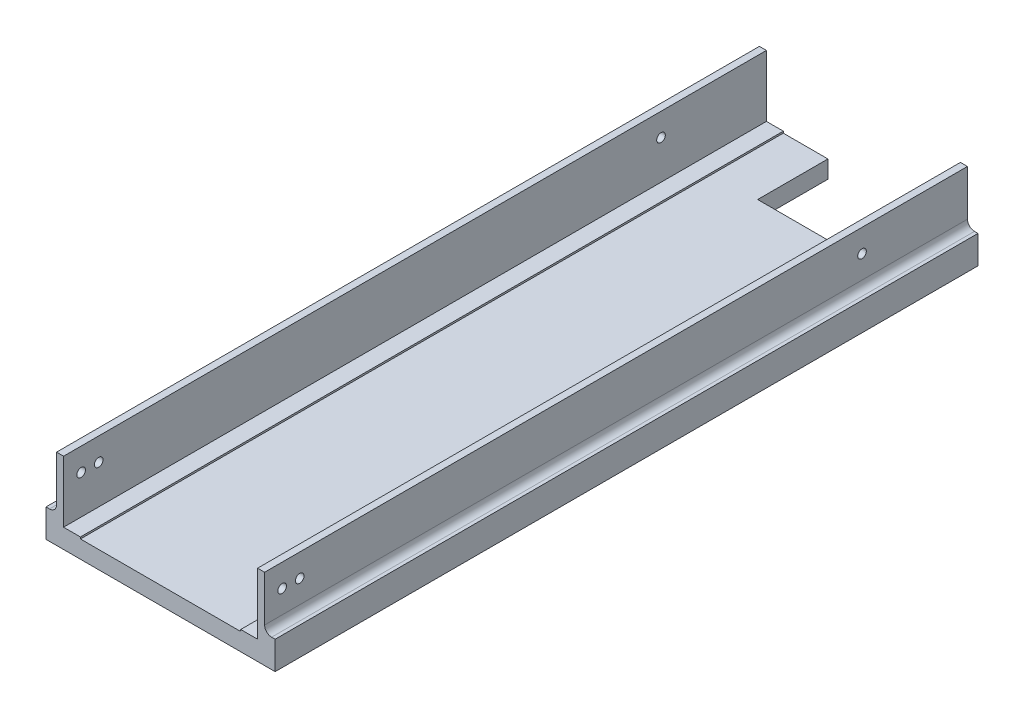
SolidWorks part; units mm, degrees
ref_plane "Front Plane" through (0, 0, 0) normal (0, 0, 1) x (1, 0, 0)
ref_plane "Top Plane" through (0, 0, 0) normal (0, 1, 0) x (1, 0, 0)
ref_plane "Right Plane" through (0, 0, 0) normal (1, 0, 0) x (0, 0, -1)
sketch "Sketch1" plane through (0, 0, 0) normal (0, 0, 1) x (1, 0, 0)
  line L0 (0, 0) -> (0, 25)
  line L1 (0, 25) -> (5, 25)
  line L2 (5, 25) -> (5, 5)
  line L3 (5, 5) -> (60.2, 5)
  line L4 (60.2, 5) -> (60.2, 25)
  line L5 (60.2, 25) -> (65.2, 25)
  line L6 (65.2, 25) -> (65.2, 0)
  line L7 (65.2, 0) -> (0, 0)
  dimension "D1" = 5
  dimension "D2" = 5
  dimension "D3" = 55.2
  dimension "D4" = 5
  dimension "D5" = 20
  dimension "D6" = 20
extrude "Boss-Extrude1" add sketch "Sketch1" along normal blind 400
sketch "Sketch2" plane through (0, 5, 0) normal (0, 1, 0) x (1, 0, 0)
  line L1 (29.51, -63.42) -> (35.69, -63.42)
  line L2 (29.51, -63.42) -> (29.51, -100.67)
  line L3 (29.51, -100.67) -> (35.69, -100.67)
  line L4 (35.69, -63.42) -> (35.69, -100.67)
  line L7 (60.2, -400) -> (5, -400) construction
  line L10 (0, -400) -> (0, 0) construction
  circle A0 centre (32.6, -67.17) radius 2.1
  circle A1 centre (32.6, -96.92) radius 2.1
  circle A2 centre (32.6, -67.17) radius 2.1
  circle A3 centre (32.6, -96.92) radius 2.1
  dimension "D5" = 4.2
  dimension "D1" = 6.18
  dimension "D2" = 37.25
  dimension "D3" = 299.33
  dimension "D4" = 29.51
  dimension "D6" = 3.75
  dimension "D7" = 33.5
  dimension "D8" = 3.09
  dimension "D9" = 3.09
extrude "Cut-Extrude3" cut sketch "Sketch2" against normal blind 10 contours A0 | A1
sketch "Sketch3" plane through (0, 25, 0) normal (0, 1, 0) x (1, 0, 0)
  line L1 (-34.8959, 47.3477) -> (123.1433, 47.3477)
  line L2 (-34.8959, 47.3477) -> (-34.8959, -450.6402)
  line L3 (-34.8959, -450.6402) -> (123.1433, -450.6402)
  line L4 (123.1433, 47.3477) -> (123.1433, -450.6402)
extrude "Cut-Extrude4" cut sketch "Sketch3" against normal blind 2
sketch "Sketch4" plane through (0, 5, 0) normal (0, 1, 0) x (1, 0, 0)
  line L0 (60.2, -400) -> (5, -400) construction
  line L1 (5, 0) -> (9.8, 0)
  line L2 (5, 0) -> (5, -400)
  line L3 (5, -400) -> (9.8, -400)
  line L4 (9.8, 0) -> (9.8, -400)
  line L5 (60.2, 0) -> (5, 0) construction
  line L6 (55.4, 0) -> (60.2, 0)
  line L7 (55.4, 0) -> (55.4, -400)
  line L8 (55.4, -400) -> (60.2, -400)
  line L9 (60.2, 0) -> (60.2, -400)
  dimension "D1" = 4.8
  dimension "D2" = 4.8
extrude "Boss-Extrude2" add sketch "Sketch4" along normal blind 8
sketch "Sketch5" plane through (5, 0, 0) normal (1, 0, 0) x (0, 0, -1)
  line L0 (-400, 13) -> (-400, 23) construction
  line L1 (0, 13) -> (-400, 13) construction
  line L2 (-200, 13) -> (-200, 23)
  line L3 (-400, 23) -> (0, 23) construction
  line L4 (-400, 0) -> (-400, 23) construction
  circle A0 centre (-395, 16.5) radius 1.2
  circle A1 centre (-390, 16.5) radius 1.2
  circle A2 centre (-5, 16.5) radius 1.2
  circle A3 centre (-10, 16.5) radius 1.2
  dimension "D1" = 2.4
  dimension "D2" = 2.4
  dimension "D3" = 5
  dimension "D4" = 10
  dimension "D5" = 3.5
  dimension "D6" = 3.5
  dimension "D7" = 200
extrude "Cut-Extrude9" cut sketch "Sketch5" against normal through all contours A0 | A1 | A3 | A2
sketch "Sketch9" plane through (0, 0, 0) normal (-1, 0, 0) x (0, 0, 1)
  circle A0 centre (5, 16.5) radius 1.225
  circle A1 centre (10, 16.5) radius 1.225
  circle A2 centre (390, 16.5) radius 1.225
  circle A3 centre (395, 16.5) radius 1.225
  dimension "D1" = 2.45
extrude "Cut-Extrude10" cut sketch "Sketch9" against normal through all
sketch "Sketch10" plane through (0, 13, 0) normal (0, 1, 0) x (1, 0, 0)
  line L1 (5, 0) -> (9.8, 0)
  line L2 (5, 0) -> (5, -400)
  line L3 (5, -400) -> (9.8, -400)
  line L4 (9.8, 0) -> (9.8, -400)
  line L5 (55.4, -400) -> (60.2, -400)
  line L6 (55.4, -400) -> (55.4, 0)
  line L7 (55.4, 0) -> (60.2, 0)
  line L8 (60.2, -400) -> (60.2, 0)
extrude "Cut-Extrude11" cut sketch "Sketch10" against normal blind 5
sketch "Sketch12" plane through (0, 0, 0) normal (0, -1, 0) x (1, 0, 0)
  circle A0 centre (32.6, 96.92) radius 2.1
  circle A1 centre (32.6, 67.17) radius 2.1
extrude "Boss-Extrude3" add sketch "Sketch12" against normal blind 15
sketch "Sketch13" plane through (0, 5, 0) normal (0, 1, 0) x (1, 0, 0)
  line L1 (29.51, -63.42) -> (35.69, -63.42)
  line L2 (29.51, -63.42) -> (29.51, -100.67)
  line L3 (29.51, -100.67) -> (35.69, -100.67)
  line L4 (35.69, -63.42) -> (35.69, -100.67)
  circle A0 centre (32.6, -67.17) radius 2.1 construction
  circle A1 centre (32.6, -67.17) radius 2.1 construction
  dimension "D2" = 3.75
  dimension "D1" = 3.09
  dimension "D3" = 37.25
  dimension "D4" = 6.18
extrude "Boss-Extrude5" add sketch "Sketch13" along normal blind 10
sketch "Sketch14" plane through (29.51, 0, 0) normal (-1, 0, 0) x (0, 0, 1)
  line L0 (70.92, 15) -> (75.32, 19.4)
  line L1 (63.42, 15) -> (100.67, 15) construction
  line L2 (75.32, 19.4) -> (88.77, 19.4)
  line L3 (88.77, 19.4) -> (93.17, 15)
  line L4 (63.42, 15) -> (63.42, 5) construction
  line L5 (70.92, 15) -> (93.17, 15)
  dimension "D1" = 13.45
  dimension "D2" = 4.4
  dimension "D3" = 4.4
  dimension "D4" = 4.4
  dimension "D5" = 7.5
extrude "Boss-Extrude6" add sketch "Sketch14" against normal up to surface (6.18 mm away)
sketch "Sketch15" plane through (29.51, 0, 0) normal (-1, 0, 0) x (0, 0, 1)
  line L0 (100.67, 15) -> (100.67, 5) construction
  line L1 (63.42, 15) -> (63.42, 5) construction
  line L2 (88.77, 19.4) -> (75.32, 19.4) construction
  circle A0 centre (78.87, 16) radius 1.05
  circle A1 centre (85.22, 16) radius 1.05
  dimension "D4" = 3.4
  dimension "D5" = 2.1
  dimension "D6" = 2.1
  dimension "D1" = 15.45
  dimension "D2" = 15.45
  dimension "D3" = 3.4
extrude "Cut-Extrude12" cut sketch "Sketch15" against normal blind 10
fillet "Fillet1" radius 2 8 edges at (29.51, 10, 100.67) (35.69, 10, 100.67) (35.69, 10, 63.42) (29.51, 10, 63.42) (32.6, 5, 100.67) (35.69, 5, 82.045) (32.6, 5, 63.42) (29.51, 5, 82.045)
sketch "Sketch16" plane through (0, 8, 0) normal (0, 1, 0) x (1, 0, 0)
  line L1 (5, 0) -> (9.8, 0)
  line L2 (5, 0) -> (5, -400)
  line L3 (5, -400) -> (9.8, -400)
  line L4 (9.8, 0) -> (9.8, -400)
  line L5 (55.4, -400) -> (60.2, -400)
  line L6 (55.4, -400) -> (55.4, 0)
  line L7 (55.4, 0) -> (60.2, 0)
  line L8 (60.2, -400) -> (60.2, 0)
extrude "Cut-Extrude13" cut sketch "Sketch16" against normal blind 2.5
sketch "Sketch17" plane through (29.51, 0, 0) normal (-1, 0, 0) x (0, 0, 1)
  circle A0 centre (78.87, 16) radius 1.16
  circle A1 centre (85.22, 16) radius 1.16
  dimension "D1" = 2.32
  dimension "D2" = 2.32
extrude "Cut-Extrude14" cut sketch "Sketch17" against normal up to next
sketch "Sketch18" plane through (60.2, 0, 0) normal (-1, 0, 0) x (0, 0, 1)
  line L0 (5, 16.5) -> (170, 16.5)
  circle A0 centre (170, 16.5) radius 1.225
  circle A1 centre (5, 16.5) radius 1.225 construction
  dimension "D1" = 165
extrude "Cut-Extrude16" cut sketch "Sketch18" against normal through all and the other way through all
sketch "Sketch20" plane through (60.2, 0, 0) normal (-1, 0, 0) x (0, 0, 1)
  line L0 (395, 16.5) -> (230, 16.5)
  circle A0 centre (230, 16.5) radius 1.225
  circle A1 centre (395, 16.5) radius 1.225 construction
  dimension "D1" = 165
extrude "Cut-Extrude17" cut sketch "Sketch20" against normal through all and the other way through all
sketch "Sketch22" plane through (0, 0, 0) normal (0, 0, -1) x (-1, 0, 0)
  line L1 (-65.2, 23) -> (-62.2, 23)
  line L2 (-65.2, 23) -> (-65.2, 8)
  line L3 (-65.2, 8) -> (-62.2, 8)
  line L4 (-62.2, 23) -> (-62.2, 8)
  line L5 (0, 23) -> (-3, 23)
  line L6 (0, 23) -> (0, 8)
  line L7 (0, 8) -> (-3, 8)
  line L8 (-3, 23) -> (-3, 8)
  dimension "D1" = 15
  dimension "D2" = 3
  dimension "D3" = 3
  dimension "D4" = 15
extrude "Cut-Extrude18" cut sketch "Sketch22" against normal through all
fillet "Fillet2" radius 2 1 edges at (62.2, 8, 200)
fillet "Fillet3" radius 2 1 edges at (3, 8, 200)
sketch "Sketch24" plane through (0, 23, 0) normal (0, 1, 0) x (1, 0, 0)
  line L0 (0, -200) -> (65.2, -200)
  line L1 (0, 0) -> (65.2, 0)
  line L2 (0, 0) -> (0, -400)
  line L3 (0, -400) -> (65.2, -400)
  line L4 (65.2, 0) -> (65.2, -400)
  line L6 (22.5, -200) -> (42.7, -200)
  line L7 (22.5, -200) -> (22.5, -220)
  line L8 (22.5, -220) -> (42.7, -220)
  line L9 (42.7, -200) -> (42.7, -220)
  dimension "D1" = 20.2
  dimension "D2" = 22.5
  dimension "D3" = 20
extrude "Cut-Extrude21" cut sketch "Sketch24" against normal through all contours L1 L2 L0 M5 | L9 L0 L7 L8 | L0 M5 M3 M4 | L4 L1 L0 M3
